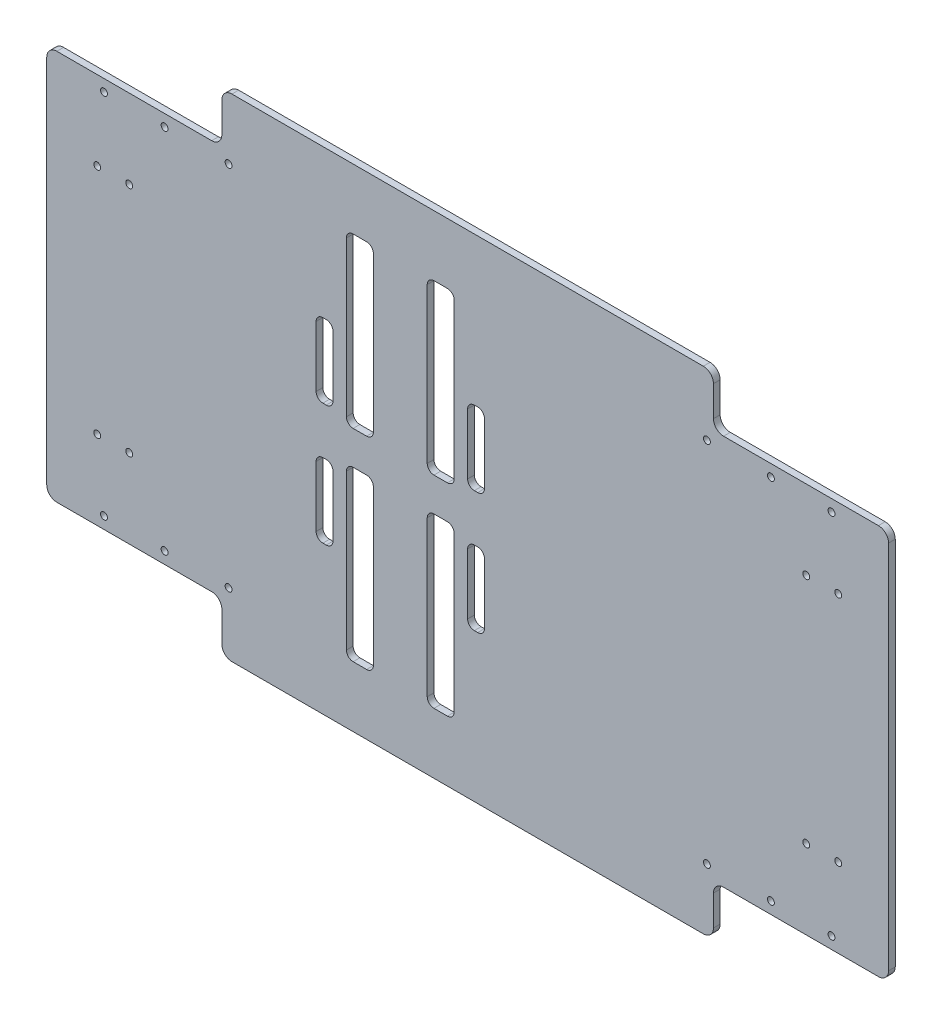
SolidWorks part; units mm, degrees
ref_plane "前视基准面" through (0, 0, 0) normal (0, 0, 1) x (1, 0, 0)
ref_plane "上视基准面" through (0, 0, 0) normal (0, 1, 0) x (1, 0, 0)
ref_plane "右视基准面" through (0, 0, 0) normal (1, 0, 0) x (0, 0, -1)
other "Configuration Table"
sketch "草图1" plane through (0, 0, 0) normal (0, 0, 1) x (1, 0, 0)
  line L0 (0, 0) -> (-50016.3474, 0) construction
  line L1 (-125, 73) -> (125, 73)
  line L2 (-125, 73) -> (-125, -73)
  line L3 (-125, -73) -> (125, -73)
  line L4 (125, 73) -> (125, -73)
  line L5 (-125, 73) -> (125, -73) construction
  line L6 (-125, -73) -> (125, 73) construction
  line L7 (0, 0) -> (0, -50016.3474) construction
  line L8 (-125, 73) -> (-125, 58)
  line L9 (-125, 58) -> (-73, 58)
  line L10 (-73, 58) -> (-73, 73)
  line L11 (-73, 73) -> (-125, 73)
  line L12 (-73, -73) -> (-125, -73)
  line L13 (-73, -58) -> (-73, -73)
  line L14 (-125, -58) -> (-73, -58)
  line L15 (-125, -73) -> (-125, -58)
  line L16 (125, -73) -> (125, -58)
  line L17 (125, -58) -> (73, -58)
  line L18 (73, -58) -> (73, -73)
  line L19 (73, -73) -> (125, -73)
  line L20 (73, 73) -> (125, 73)
  line L21 (73, 58) -> (73, 73)
  line L22 (125, 58) -> (73, 58)
  line L23 (125, 73) -> (125, 58)
  line L24 (125, 73) -> (125, -73)
  line L25 (-20, 73) -> (-20, -73) construction
  line L26 (5, 7) -> (0, 7)
  line L27 (-36, 55) -> (-28, 55)
  line L28 (-36, 55) -> (-36, 5)
  line L29 (-36, 5) -> (-28, 5)
  line L30 (-28, 55) -> (-28, 5)
  line L31 (-36, 55) -> (-28, 5) construction
  line L32 (-36, 5) -> (-28, 55) construction
  line L33 (-45, 29) -> (-40, 29)
  line L34 (-45, 29) -> (-45, 7)
  line L35 (-45, 7) -> (-40, 7)
  line L36 (-40, 29) -> (-40, 7)
  line L37 (-45, 29) -> (-40, 7) construction
  line L38 (-45, 7) -> (-40, 29) construction
  line L39 (0, 29) -> (0, 7)
  line L40 (5, 29) -> (0, 29)
  line L41 (5, 29) -> (5, 7)
  line L42 (-4, 5) -> (-12, 5)
  line L43 (-12, 55) -> (-12, 5)
  line L44 (-4, 55) -> (-12, 55)
  line L45 (-4, 55) -> (-4, 5)
  line L46 (5, -29) -> (5, -7)
  line L47 (5, -29) -> (0, -29)
  line L48 (0, -29) -> (0, -7)
  line L49 (5, -7) -> (0, -7)
  line L50 (-4, -55) -> (-4, -5)
  line L51 (-4, -55) -> (-12, -55)
  line L52 (-12, -55) -> (-12, -5)
  line L53 (-4, -5) -> (-12, -5)
  line L54 (-45, -7) -> (-40, -7)
  line L55 (-40, -29) -> (-40, -7)
  line L56 (-45, -29) -> (-40, -29)
  line L57 (-45, -29) -> (-45, -7)
  line L58 (-36, -5) -> (-28, -5)
  line L59 (-28, -55) -> (-28, -5)
  line L60 (-36, -55) -> (-28, -55)
  line L61 (-36, -55) -> (-36, -5)
  point P0 (0, 0)
  point P24 (-32, 30)
  point P29 (-42.5, 18)
  dimension "D1" = 250
  dimension "D2" = 146
  dimension "D3" = 52
  dimension "D4" = 15
  dimension "D5" = 105
  dimension "D6" = 8
  dimension "D7" = 50
  dimension "D8" = 22
  dimension "D9" = 5
  dimension "D10" = 8
  dimension "D11" = 5
  dimension "D12" = 20
  dimension "D13" = 7
extrude "凸台-拉伸1" add sketch "草图1" along normal blind 2 contours L4 L22 L21 L1 L10 L9 L2 L14 L13 L3 L18 L17 L53 L50 L51 L52 L49 L46 L47 L48 L27 L30 L29 L28 L33 L36 L35 L34 L40 L41 L26 L39 L44 L45 L42 L43 L56 L57 L54 L55 L60 L61 L58
fillet "圆角1" radius 3 12 edges at (-125, 58, 1) (-73, 58, 1) (-73, 73, 1) (73, 73, 1) (73, 58, 1) (125, 58, 1) (125, -58, 1) (73, -58, 1) (73, -73, 1) (-73, -73, 1) (-73, -58, 1) (-125, -58, 1)
fillet "圆角2" radius 2 32 edges at (-40, 29, 1) (-45, 29, 1) (-36, 55, 1) (-28, 55, 1) (-4, 55, 1) (-12, 55, 1) (0, 29, 1) (5, 29, 1) (-45, 7, 1) (-40, 7, 1) (-36, 5, 1) (-28, 5, 1) (-12, 5, 1) (-4, 5, 1) (0, 7, 1) (5, 7, 1) (-45, -29, 1) (-40, -29, 1) (-45, -7, 1) (-40, -7, 1) (-36, -5, 1) (-28, -5, 1) (-36, -55, 1) (-28, -55, 1) (-12, -55, 1) (-4, -55, 1) (-12, -5, 1) (-4, -5, 1) (0, -7, 1) (5, -7, 1) (0, -29, 1) (5, -29, 1)
hole_wizard "M2.5 螺纹孔1" positions "草图2" profile "草图3" tap size "M2.5" standard "GB"
sketch "草图2" plane through (0, 0, 0) normal (0, 0, -1) x (-1, 0, 0)
  point P0 (110, 34.5)
  point P3 (100.5, 34.5)
  point P6 (108, 54.5)
  point P9 (90, 54.5)
  point P12 (71, 54.5)
  point P15 (110, -34.5)
  point P18 (100.5, -34.5)
  point P21 (71, -54.5)
  point P24 (90, -54.5)
  point P27 (108, -54.5)
sketch "草图3" plane through (-110, 34.5, 0) normal (1, 0, 0) x (0, 1, 0)
  line L0 (0, 0) -> (0, 2.6159)
  line L1 (0, 2.6159) -> (1.025, 2)
  line L2 (1.025, 2) -> (1.025, 0)
  line L5 (1.025, 0) -> (0, 0)
  line L10 (0, 2.6159) -> (-1.025, 2) construction
  line L11 (0, -6.35) -> (0, 107.95) construction
  dimension "螺纹孔钻头直径" = 2.05
  dimension "螺纹孔钻头深度" = 2
  dimension "导头角度" = 118
hole_wizard "M2.5 螺纹孔2" positions "草图4" profile "草图5" tap size "M2.5" standard "GB"
sketch "草图4" plane through (0, 0, 0) normal (0, 0, -1) x (-1, 0, 0)
  point P0 (-108.0718, 54.5)
  point P3 (-90.0718, 54.5)
  point P6 (-71.0718, 54.5)
  point P9 (-100.5718, 34.5)
  point P12 (-110.0718, 34.5)
  point P15 (-110.0718, -34.5)
  point P18 (-100.5718, -34.5)
  point P21 (-108.0718, -54.5)
  point P24 (-90.0718, -54.5)
  point P27 (-71.0718, -54.5)
  point P30 (0, 0)
sketch "草图5" plane through (108.0718, 54.5, 0) normal (1, 0, 0) x (0, 1, 0)
  line L0 (0, 0) -> (0, 3.9659)
  line L1 (0, 3.9659) -> (1.025, 3.35)
  line L2 (1.025, 3.35) -> (1.025, 0)
  line L5 (1.025, 0) -> (0, 0)
  line L10 (0, 3.9659) -> (-1.025, 3.35) construction
  line L11 (0, -6.35) -> (0, 107.95) construction
  dimension "螺纹孔钻头直径" = 2.05
  dimension "螺纹孔钻头深度" = 3.35
  dimension "导头角度" = 118
